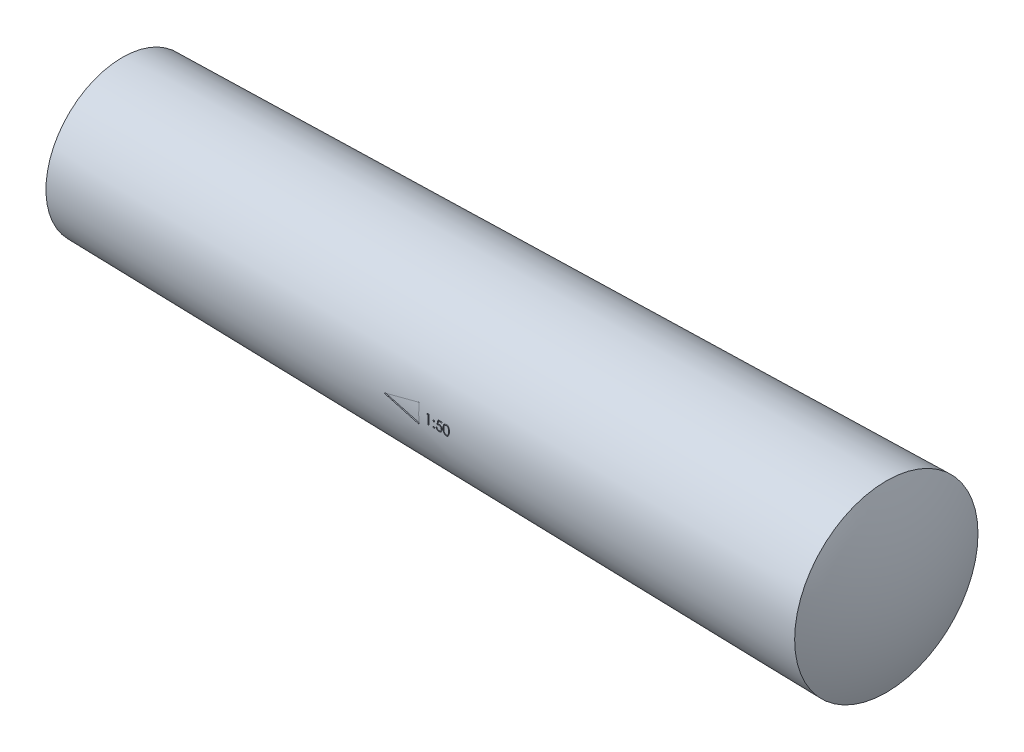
SolidWorks part; units mm, degrees
ref_plane "Front Plane" through (0, 0, 0) normal (0, 0, 1) x (1, 0, 0)
ref_plane "Top Plane" through (0, 0, 0) normal (0, 1, 0) x (1, 0, 0)
ref_plane "Right Plane" through (0, 0, 0) normal (1, 0, 0) x (0, 0, -1)
sketch "Sketch1" plane through (0, 0, 0) normal (1, 0, 0) x (0, 0, -1)
  circle A0 centre (0, 0) radius 8
  dimension "D1" = 16
extrude "Extrude1" add sketch "Sketch1" along normal mid plane 80
draft "Draft1" type of draft neutral plane draft angle 1.146 faces to draft 1 parameters "D1"=1.146
sketch "Sketch2" plane through (0, 0, 0) normal (0, 0, 1) x (1, 0, 0)
  line L0 (-40, 0) -> (-40, 8)
  line L1 (-40, 8) -> (-40, -8) construction
  line L2 (-40, 0) -> (-42, 0)
  line L3 (-42, 0) -> (-42, -8.8) construction
  line L4 (40, 0) -> (40, 9.6001)
  line L5 (40, -9.6001) -> (40, 9.6001) construction
  line L6 (40, 0) -> (42, 0)
  line L7 (42, 0) -> (42, -8.8) construction
  line L8 (-40, -8) -> (40, -9.6001) construction
  arc A0 (-42, 0) -> (-40, 8) centre (-25, 0) cw
  arc A1 (42, 0) -> (40, 9.6001) centre (17.9598, 0) ccw
  point P14 (0, -8.8)
revolve "Revolve1" add sketch "Sketch2" angle 360 about L2
sketch "Sketch5" plane through (0, 0, 0) normal (0, 0, 1) x (1, 0, 0)
  line L0 (0, 8.8) -> (0, -8.8) construction
  line L1 (40, 9.6001) -> (-40, 8) construction
  line L2 (-40, -8) -> (40, -9.6001) construction
ref_plane "Plane2" through (0, 0, 0) normal (-0.02, 0, 0.9998) x (0.9998, 0, 0.02)
sketch "Sketch6" plane through (0, 0, 0) normal (-0.02, 0, 0.9998) x (0.9998, 0, 0.02)
  line L0 (0, 0) -> (0, 1)
  line L1 (0, 8.8) -> (0, -8.8) construction
  line L2 (0, 1) -> (-3.7321, 0)
  line L3 (-3.7321, 0) -> (0, -1)
  line L4 (0, -1) -> (0, 0)
  line L5 (0, -0.5) -> (4, -0.5) construction
  text T0 "1:50" font "Century Gothic" height 1
  dimension "D1" = 2
  dimension "D2" = 30
  dimension "D3" = 4
wrap "Wrap2" sketch "Sketch6" wrap type deboss source sketch "Sketch6" thickness 0.1 parameters "D1"=0.1
equation "\"D2@Sketch2\" = \"D1@Sketch2\""
